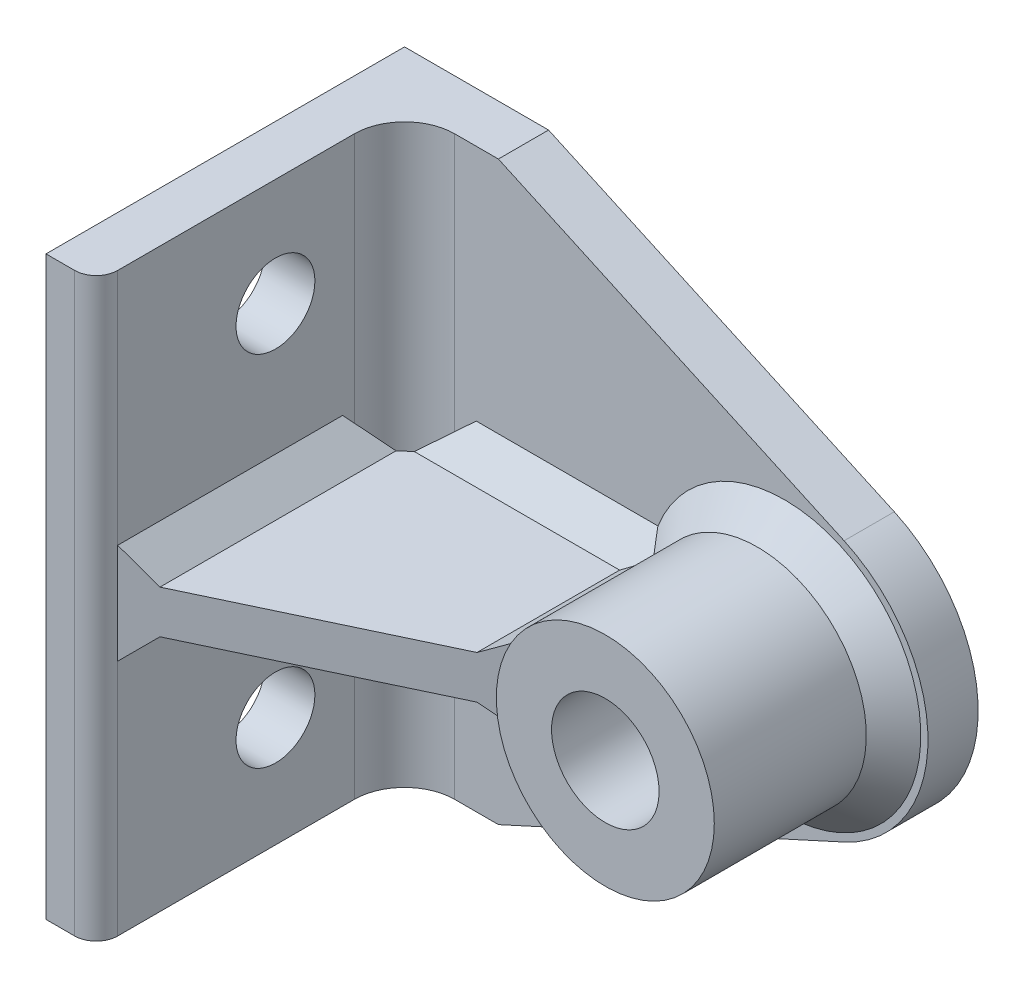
SolidWorks part; units mm, degrees
ref_plane "Plan1" through (0, 0, 0) normal (0, 0, 1) x (1, 0, 0)
ref_plane "Plan2" through (0, 0, 0) normal (0, 1, 0) x (1, 0, 0)
ref_plane "Plan3" through (0, 0, 0) normal (1, 0, 0) x (0, 0, -1)
sketch "Esquisse1" plane through (0, 0, 0) normal (0, 0, 1) x (1, 0, 0)
  line L0 (-40, 0) -> (100, 0) construction
  line L1 (0, -40.1938) -> (0, 40.1938)
  line L2 (0, 40.1938) -> (20.0884, 40.1938)
  line L3 (0, -40.1938) -> (20.0884, -40.1938)
  line L4 (60, -10) -> (60, 10) construction
  line L5 (20.0884, 40.1938) -> (68.302, 18.1955)
  line L6 (20.0884, -40.1938) -> (68.302, -18.1955)
  arc A0 (68.302, -18.1955) -> (68.302, 18.1955) centre (60, 0) ccw
  point P6 (0, 0)
  point P11 (60, 0)
  point P12 (60, 0)
  dimension "D1" = 60
extrude "Base-Extrusion" add sketch "Esquisse1" along normal blind 50
sketch "Esquisse2" plane through (0, -40.1938, 0) normal (0, -1, 0) x (1, 0, 0)
  line L0 (80, 0) -> (80, 50) construction
  line L1 (80, 7) -> (14, 7)
  line L2 (80, 7) -> (80, 50)
  line L3 (80, 50) -> (7, 50)
  line L4 (7, 14) -> (7, 50)
  line L5 (0, 50) -> (20.0884, 50) construction
  line L6 (20.0884, 0) -> (68.302, 0) construction
  line L7 (0, 50) -> (0, 0) construction
  arc A0 (14, 7) -> (7, 14) centre (14, 14) cw
  dimension "D3" = 7
  dimension "D1" = 7
  dimension "D2" = 7
extrude "Enlèv. mat.-Extru.1" cut sketch "Esquisse2" against normal through all
fillet "Congé1" radius 3
sketch "Esquisse3" plane through (0, 0, 0) normal (0, 1, 0) x (1, 0, 0)
  line L0 (7, -15.6331) -> (17, -7)
  line L1 (7, -47) -> (7, -14) construction
  line L2 (14, -7) -> (20.0884, -7) construction
  line L3 (7, -47) -> (45, -29)
  line L4 (45, -29) -> (45, -7)
  line L5 (20.0884, -7) -> (68.302, -7) construction
  line L6 (17, -7) -> (45, -7)
  line L7 (0, -50) -> (0, 0) construction
  line L8 (7, -15.6331) -> (7, -47)
  dimension "D1" = 22
  dimension "D2" = 28
  dimension "D3" = 45
extrude "Boss.-Extru.1" add sketch "Esquisse3" along normal mid plane 6
sketch "Esquisse6" plane through (0, 0, 7) normal (0, 0, 1) x (1, 0, 0)
  circle A0 centre (60, 0) radius 15.2
extrude "Boss.-Extru.7" add sketch "Esquisse6" along normal blind 25
sketch "Esquisse7" plane through (0, 0, 32) normal (0, 0, 1) x (1, 0, 0)
  circle A0 centre (60, 0) radius 7.5
extrude "Enlèv. mat.-Extru.3" cut sketch "Esquisse7" against normal through all
sketch "Esquisse8" plane through (7, 0, 0) normal (1, 0, 0) x (0, 0, -1)
  line L0 (-47, 40.1938) -> (-14, 40.1938) construction
  line L1 (-50, -40.1938) -> (-50, 40.1938) construction
  circle A0 centre (-25, 25.1938) radius 5.5
  circle A1 centre (-25, -24.8062) radius 5.5
  dimension "D1" = 11
  dimension "D2" = 11
  dimension "D3" = 15
  dimension "D4" = 50
  dimension "D5" = 25
  dimension "D6" = 25
extrude "Enlèv. mat.-Extru.4" cut sketch "Esquisse8" against normal through all
sketch "Esquisse9" plane through (0, 0, 7) normal (0, 0, 1) x (1, 0, 0)
  line L0 (7, 3) -> (7, 7)
  line L1 (7, 3) -> (11, 3)
  line L2 (11, 3) -> (7, 7)
  line L3 (7, -3) -> (7, -7)
  line L4 (7, -7) -> (11, -3)
  line L5 (7, -3) -> (45, -3) construction
  line L6 (11, -3) -> (7, -3)
  line L7 (45, 3) -> (41, 3)
  line L8 (45, 3) -> (46, 6)
  line L9 (46, 6) -> (41, 3)
  line L10 (45, -3) -> (41, -3)
  line L11 (45, -3) -> (46, -5.9195)
  line L12 (46, -5.9195) -> (41, -3)
  circle A0 centre (60, 0) radius 15.2 construction
extrude "Boss.-Extru.8" add sketch "Esquisse9" along normal up to surface (40 mm away)
sketch "Esquisse10" plane through (7, 0, 0) normal (1, 0, 0) x (0, 0, -1)
  line L0 (-7, 3) -> (-11, 3)
  line L1 (-29, 3) -> (-7, 3) construction
  line L2 (-7, 3) -> (-7, 7)
  line L3 (-7, 18.1955) -> (-7, -18.1955) construction
  line L4 (-7, 7) -> (-11, 3)
  line L5 (-7, -3) -> (-11, -3)
  line L6 (-29, -3) -> (-7, -3) construction
  line L7 (-11, -3) -> (-7, -7)
  line L8 (-7, -7) -> (-7, -3)
extrude "Boss.-Extru.9" add sketch "Esquisse10" against normal up to surface (38.099 mm away)
sketch "Esquisse11" plane through (0, 0, 0) normal (0, 1, 0) x (1, 0, 0)
  line L0 (75, -7) -> (79, -7)
  line L1 (75, -7) -> (75, -11)
  line L2 (75, -11) -> (79, -7)
  line L3 (60, -33.7209) -> (60, -44.832) construction
  line L4 (60, -32) -> (60, -7) construction
revolve "Boss.-Révol.1" add sketch "Esquisse11" angle 360 about L3
sketch "Esquisse12" plane through (0, -3, 0) normal (0, -1, 0) x (1, 0, 0)
  line L0 (12.3667, 11) -> (11, 12.1798)
  line L2 (11, 12.1798) -> (7, 15.6331)
  line L3 (7, 47) -> (7, 14) construction
  line L4 (7, 15.6331) -> (7, 14)
  line L5 (12.3667, 11) -> (17, 7)
  line L6 (17, 7) -> (14, 7)
  arc A0 (7, 14) -> (14, 7) centre (14, 14) ccw
extrude "Enlèv. mat.-Extru.5" cut sketch "Esquisse12" against normal through all and the other way through all
